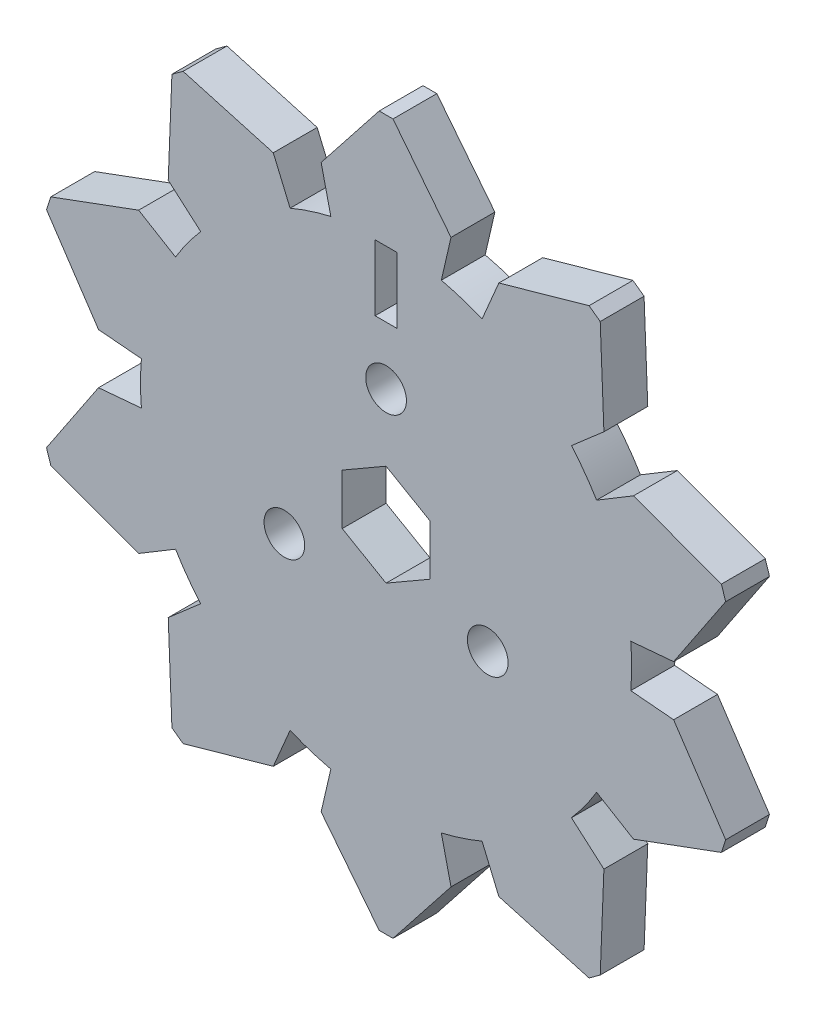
SolidWorks part; units mm, degrees
ref_plane "Front Plane" through (0, 0, 0) normal (0, 0, 1) x (1, 0, 0)
ref_plane "Top Plane" through (0, 0, 0) normal (0, 1, 0) x (1, 0, 0)
ref_plane "Right Plane" through (0, 0, 0) normal (1, 0, 0) x (0, 0, -1)
sketch "Sketch1" plane through (0, 0, 0) normal (0, 0, 1) x (1, 0, 0)
  line L0 (0, 26.2856) -> (0, -26.2856) construction
  line L1 (15.4503, 21.2655) -> (-15.4503, -21.2655) construction
  line L3 (-3.9996, 17.3243) -> (-4.7004, 20.3595)
  line L4 (-4.7004, 20.3595) -> (-0.5, 25.6863)
  line L5 (-0.5, 25.6863) -> (0.5, 25.6863)
  line L6 (4.7004, 20.3595) -> (0.5, 25.6863)
  line L7 (3.9996, 17.3243) -> (4.7004, 20.3595)
  line L8 (0, 0) -> (-6.9472, 16.3666) construction
  line L9 (6.9472, 16.3666) -> (8.1644, 19.234)
  line L10 (8.1644, 19.234) -> (14.6935, 21.0745)
  line L11 (14.6935, 21.0745) -> (15.5025, 20.4868)
  line L12 (15.7697, 13.7084) -> (15.5025, 20.4868)
  line L13 (13.4187, 11.6647) -> (15.7697, 13.7084)
  line L14 (15.2404, 9.1574) -> (17.9106, 10.7618)
  line L15 (17.9106, 10.7618) -> (24.2746, 8.413)
  line L16 (24.2746, 8.413) -> (24.5836, 7.462)
  line L17 (20.8156, 1.8211) -> (24.5836, 7.462)
  line L18 (17.7123, 1.5496) -> (20.8156, 1.8211)
  line L19 (17.7123, -1.5496) -> (20.8156, -1.8211)
  line L20 (20.8156, -1.8211) -> (24.5836, -7.462)
  line L21 (24.5836, -7.462) -> (24.2746, -8.413)
  line L22 (17.9106, -10.7618) -> (24.2746, -8.413)
  line L23 (15.2404, -9.1574) -> (17.9106, -10.7618)
  line L24 (13.4187, -11.6647) -> (15.7697, -13.7084)
  line L25 (15.7697, -13.7084) -> (15.5025, -20.4868)
  line L26 (15.5025, -20.4868) -> (14.6935, -21.0745)
  line L27 (8.1644, -19.234) -> (14.6935, -21.0745)
  line L28 (6.9472, -16.3666) -> (8.1644, -19.234)
  line L29 (3.9996, -17.3243) -> (4.7004, -20.3595)
  line L30 (4.7004, -20.3595) -> (0.5, -25.6863)
  line L31 (0.5, -25.6863) -> (-0.5, -25.6863)
  line L32 (-4.7004, -20.3595) -> (-0.5, -25.6863)
  line L33 (-3.9996, -17.3243) -> (-4.7004, -20.3595)
  line L34 (-6.9472, -16.3666) -> (-8.1644, -19.234)
  line L35 (-8.1644, -19.234) -> (-14.6935, -21.0745)
  line L36 (-14.6935, -21.0745) -> (-15.5025, -20.4868)
  line L37 (-15.7697, -13.7084) -> (-15.5025, -20.4868)
  line L38 (-13.4187, -11.6647) -> (-15.7697, -13.7084)
  line L39 (-15.2404, -9.1574) -> (-17.9106, -10.7618)
  line L40 (-17.9106, -10.7618) -> (-24.2746, -8.413)
  line L41 (-24.2746, -8.413) -> (-24.5836, -7.462)
  line L42 (-20.8156, -1.8211) -> (-24.5836, -7.462)
  line L43 (-17.7123, -1.5496) -> (-20.8156, -1.8211)
  line L44 (-17.7123, 1.5496) -> (-20.8156, 1.8211)
  line L45 (-20.8156, 1.8211) -> (-24.5836, 7.462)
  line L46 (-24.5836, 7.462) -> (-24.2746, 8.413)
  line L47 (-17.9106, 10.7618) -> (-24.2746, 8.413)
  line L48 (-15.2404, 9.1574) -> (-17.9106, 10.7618)
  line L49 (-13.4187, 11.6647) -> (-15.7697, 13.7084)
  line L50 (-15.7697, 13.7084) -> (-15.5025, 20.4868)
  line L51 (-15.5025, 20.4868) -> (-14.6935, 21.0745)
  line L52 (-8.1644, 19.234) -> (-14.6935, 21.0745)
  line L53 (-6.9472, 16.3666) -> (-8.1644, 19.234)
  line L55 (3.175, 1.8331) -> (0, 3.6662)
  line L56 (0, 3.6662) -> (-3.175, 1.8331)
  line L57 (-3.175, 1.8331) -> (-3.175, -1.8331)
  line L58 (-3.175, -1.8331) -> (0, -3.6662)
  line L59 (0, -3.6662) -> (3.175, -1.8331)
  line L60 (3.175, -1.8331) -> (3.175, 1.8331)
  circle A0 centre (0, 0) radius 3.175 construction
  arc A1 (-6.9472, 16.3666) -> (-3.9996, 17.3243) centre (0, 0) cw
  arc A2 (3.9996, 17.3243) -> (6.9472, 16.3666) centre (0, 0) cw
  arc A3 (13.4187, 11.6647) -> (15.2404, 9.1574) centre (0, 0) cw
  arc A4 (17.7123, 1.5496) -> (17.7123, -1.5496) centre (0, 0) cw
  arc A5 (15.2404, -9.1574) -> (13.4187, -11.6647) centre (0, 0) cw
  arc A6 (6.9472, -16.3666) -> (3.9996, -17.3243) centre (0, 0) cw
  arc A7 (-3.9996, -17.3243) -> (-6.9472, -16.3666) centre (0, 0) cw
  arc A8 (-13.4187, -11.6647) -> (-15.2404, -9.1574) centre (0, 0) cw
  arc A9 (-17.7123, -1.5496) -> (-17.7123, 1.5496) centre (0, 0) cw
  arc A10 (-15.2404, 9.1574) -> (-13.4187, 11.6647) centre (0, 0) cw
  point P7 (0, 0)
  point P8 (0, 0)
  point P17 (0, 25.6863)
  point P96 (0, 0)
  dimension "D1" = 6.35
  dimension "D6" = 6.7836
  dimension "D3" = 17.78
  dimension "D9" = 3.1032
  dimension "D2" = 36
  dimension "D4" = 13
  dimension "D5" = 0.5
  dimension "D8" = 38.257
  dimension "D7" = 10
extrude "Boss-Extrude1" add sketch "Sketch1" along normal blind 3.175
hole_wizard "#4 Clearance Hole1" positions "Sketch3" profile "Sketch2" hole size "#4" standard "ANSI Inch"
sketch "Sketch3" plane through (0, 0, 3.175) normal (0, 0, 1) x (1, 0, 0)
  point P0 (0, 8.5)
  point P11 (7.3612, -4.25)
  point P12 (-7.3612, -4.25)
  dimension "D1" = 8.5
  dimension "D2" = 3
sketch "Sketch2" plane through (0, 8.5, 3.175) normal (1, 0, 0) x (0, -1, 0)
  line L0 (0, 0) -> (0, 3.175)
  line L1 (0, 3.175) -> (1.4732, 3.175)
  line L2 (1.4732, 3.175) -> (1.4732, 0)
  line L5 (1.4732, 0) -> (0, 0)
  line L11 (0, -6.35) -> (0, 107.95) construction
  dimension "Thru Hole Dia." = 2.9464
  dimension "Thru Hole Depth" = 3.175
sketch "Sketch4" plane through (0, 0, 3.175) normal (0, 0, 1) x (1, 0, 0)
  line L1 (-0.7938, 17.4625) -> (0.7938, 17.4625)
  line L2 (-0.7938, 17.4625) -> (-0.7937, 12.7)
  line L3 (-0.7937, 12.7) -> (0.7937, 12.7)
  line L4 (0.7938, 17.4625) -> (0.7937, 12.7)
  point P4 (0, 12.7)
  dimension "D1" = 1.5875
  dimension "D2" = 4.7625
  dimension "D3" = 12.7
extrude "Cut-Extrude1" cut sketch "Sketch4" against normal through all
